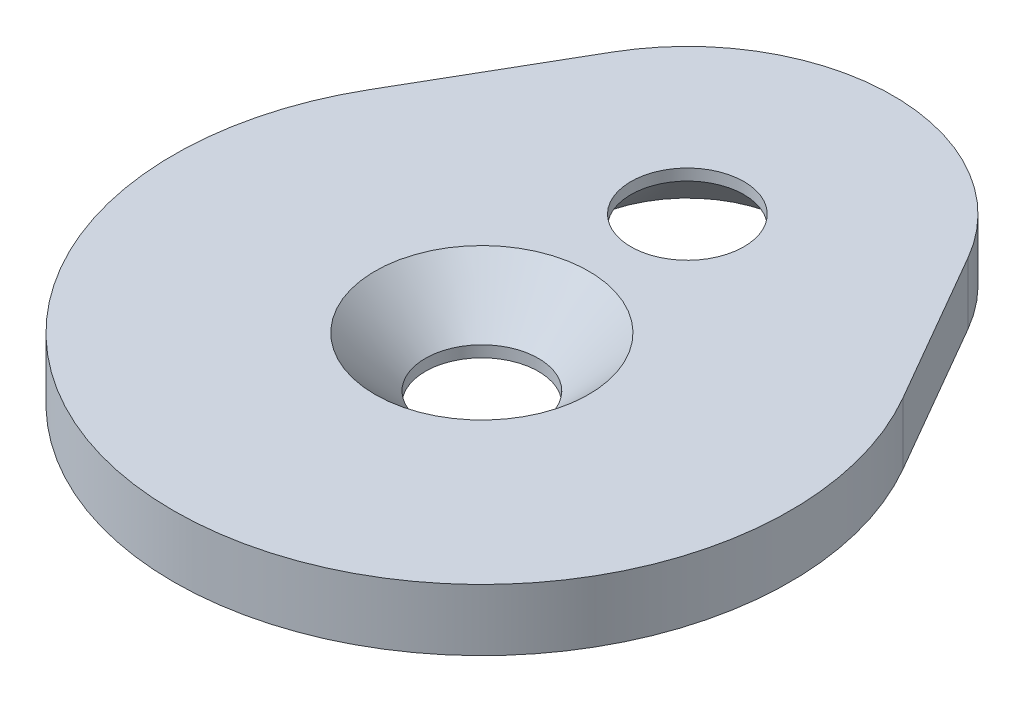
SolidWorks part; units mm, degrees
ref_plane "Front" through (0, 0, 0) normal (0, 0, 1) x (1, 0, 0)
ref_plane "Top" through (0, 0, 0) normal (0, 1, 0) x (1, 0, 0)
ref_plane "Right" through (0, 0, 0) normal (1, 0, 0) x (0, 0, -1)
sketch "Sketch1" plane through (0, 0, 0) normal (0, 1, 0) x (1, 0, 0)
  line L1 (-8.6603, 15) -> (-12.9904, 7.5)
  line L2 (8.6603, 15) -> (12.9904, 7.5)
  arc A0 (8.6603, 15) -> (-8.6603, 15) centre (0, 10) ccw
  circle A1 centre (0, 10) radius 2.5
  arc A2 (-12.9904, 7.5) -> (12.9904, 7.5) centre (0, 0) ccw
  circle A3 centre (0, 0) radius 2.5
extrude "Extrude1" add sketch "Sketch1" along normal blind 3
sketch "Sketch4" plane through (0, 3, 0) normal (0, 1, 0) x (1, 0, 0)
  point P0 (0, 0)
hole_wizard "CSK for M5 Countersunk Flat Head Screw1" positions "3DSketch2" profile "Sketch5" countersink size "M5" standard "ISO"
sketch3d "3DSketch2"
  point P0 (0, 3, 0)
sketch "Sketch5" plane through (0, 3, 0) normal (1, 0, 0) x (0, 0, 1)
  line L0 (0, 0) -> (0, 3)
  line L1 (0, 3) -> (2.75, 3)
  line L2 (2.75, 3) -> (2.75, 2.45)
  line L3 (2.75, 2.45) -> (5.2, 0)
  line L5 (5.2, 0) -> (0, 0)
  line L6 (-2.75, 2.45) -> (-5.2, 0) construction
  line L11 (0, -6.35) -> (0, 107.95) construction
  dimension "Thru Hole Dia." = 5.5
  dimension "Thru Hole Depth" = 3
  dimension "Near C'Sink Dia." = 10.4
  dimension "Near C'Sink Angle" = 90
sketch "Sketch6" plane through (0, 0, 0) normal (0, -1, 0) x (1, 0, 0)
  point P0 (0, -10)
hole_wizard "CSK for M5 Countersunk Flat Head Screw2" positions "3DSketch3" profile "Sketch7" countersink size "M5" standard "ISO"
sketch3d "3DSketch3"
  point P0 (0, 0, -10)
sketch "Sketch7" plane through (0, 0, -10) normal (1, 0, 0) x (0, 0, -1)
  line L0 (0, 0) -> (0, 3)
  line L1 (0, 3) -> (2.75, 3)
  line L2 (2.75, 3) -> (2.75, 2.45)
  line L3 (2.75, 2.45) -> (5.2, 0)
  line L5 (5.2, 0) -> (0, 0)
  line L6 (-2.75, 2.45) -> (-5.2, 0) construction
  line L11 (0, -6.35) -> (0, 107.95) construction
  dimension "Thru Hole Dia." = 5.5
  dimension "Thru Hole Depth" = 3
  dimension "Near C'Sink Dia." = 10.4
  dimension "Near C'Sink Angle" = 90
